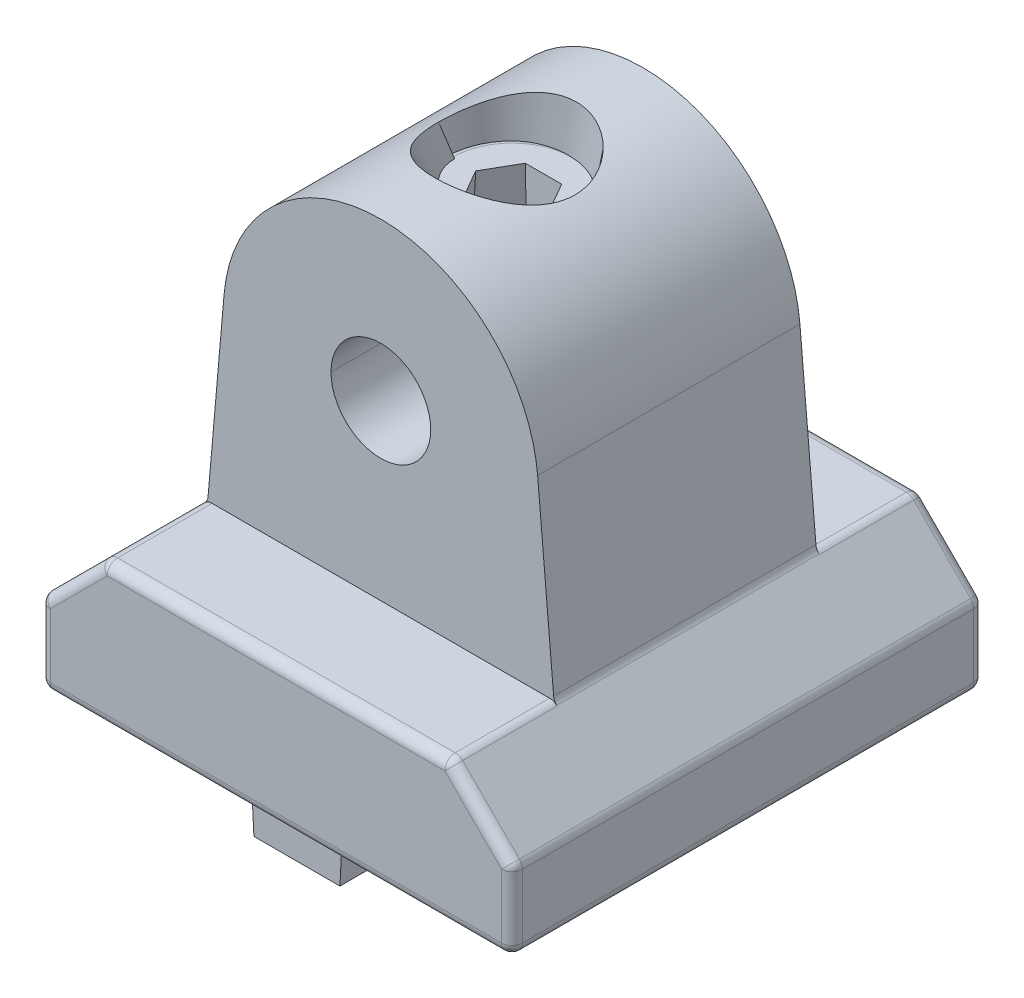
SolidWorks part; units mm, degrees
ref_plane "Front Plane" through (0, 0, 0) normal (0, 0, 1) x (1, 0, 0)
ref_plane "Top Plane" through (0, 0, 0) normal (0, 1, 0) x (1, 0, 0)
ref_plane "Right Plane" through (0, 0, 0) normal (1, 0, 0) x (0, 0, -1)
imported_body "Alaosa.STEP<1>"
fillet "Fillet1" radius 1
